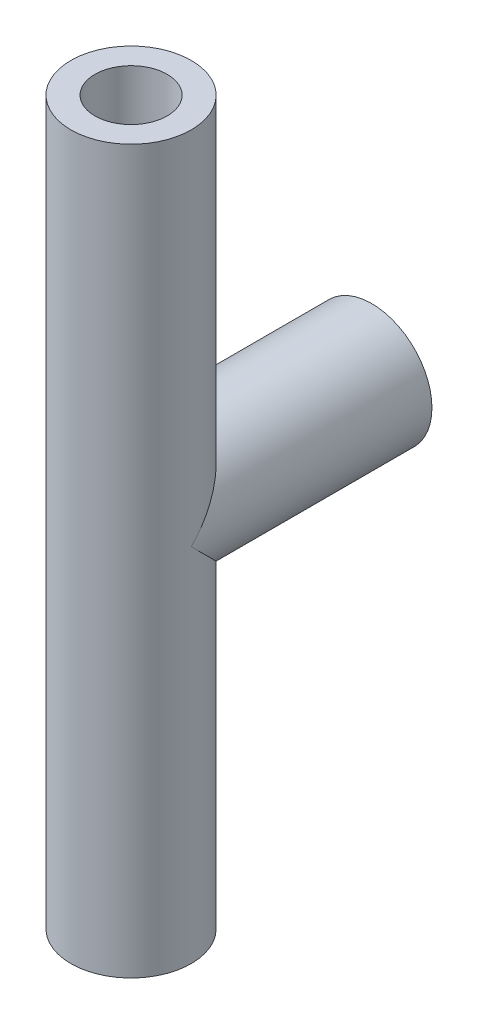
SolidWorks part; units mm, degrees
ref_plane "Front Plane" through (0, 0, 0) normal (0, 0, 1) x (1, 0, 0)
ref_plane "Top Plane" through (0, 0, 0) normal (0, 1, 0) x (1, 0, 0)
ref_plane "Right Plane" through (0, 0, 0) normal (1, 0, 0) x (0, 0, -1)
sketch "Sketch1" plane through (0, 0, 0) normal (0, 0, 1) x (1, 0, 0)
  circle A0 centre (57.15, 0) radius 6.35 construction
  circle A1 centre (57.15, 0) radius 6.35
extrude "Extrude1" add sketch "Sketch1" along normal blind 25.4
sketch "Sketch2" plane through (0, 0, 0) normal (0, 1, 0) x (1, 0, 0)
  line L0 (50.8, -25.4) -> (63.5, -25.4) construction
  circle A0 centre (57.15, -25.4) radius 6.35
extrude "Extrude2" add sketch "Sketch2" along normal mid plane 76.2
shell "Shell1" thickness 2.54
